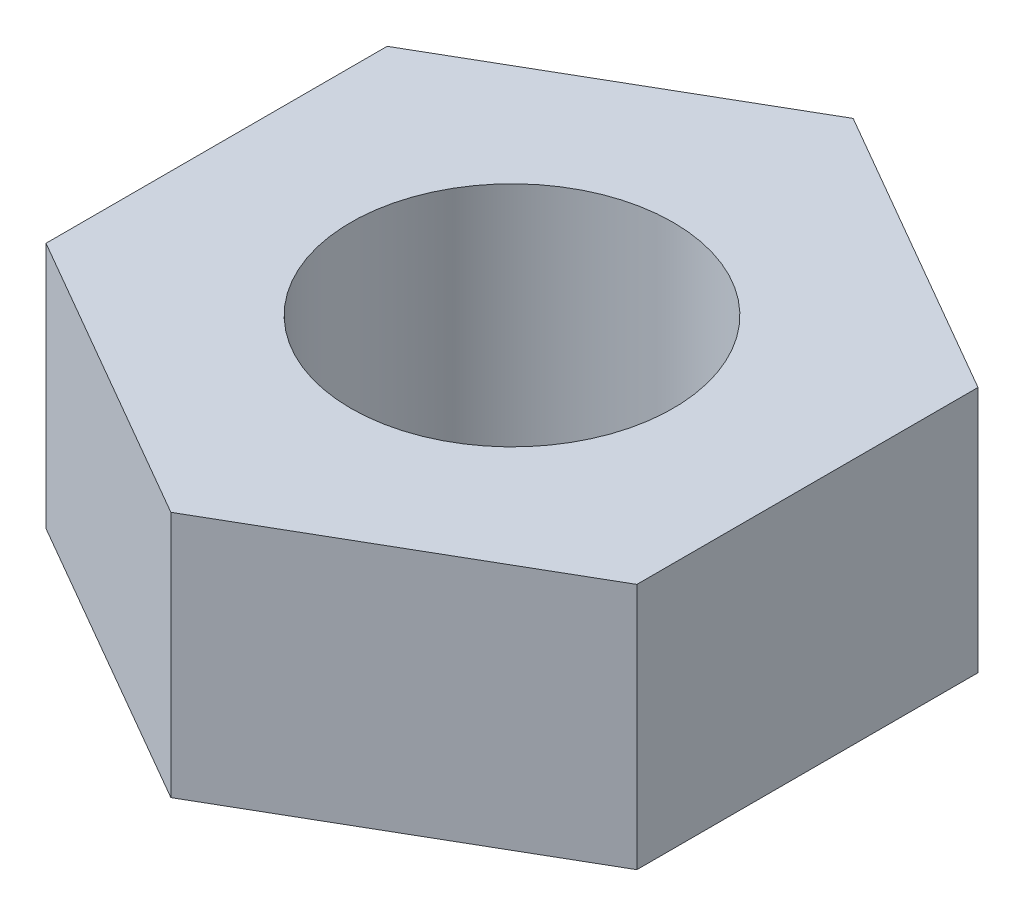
SolidWorks part; units mm, degrees
ref_plane "Front Plane" through (0, 0, 0) normal (0, 0, 1) x (1, 0, 0)
ref_plane "Top Plane" through (0, 0, 0) normal (0, 1, 0) x (1, 0, 0)
ref_plane "Right Plane" through (0, 0, 0) normal (1, 0, 0) x (0, 0, -1)
sketch "Sketch1" plane through (0, 0, 0) normal (0, 1, 0) x (1, 0, 0)
  line L1 (0, 3.1754) -> (-2.75, 1.5877)
  line L2 (-2.75, 1.5877) -> (-2.75, -1.5877)
  line L3 (-2.75, -1.5877) -> (0, -3.1754)
  line L4 (0, -3.1754) -> (2.75, -1.5877)
  line L5 (2.75, -1.5877) -> (2.75, 1.5877)
  line L6 (2.75, 1.5877) -> (0, 3.1754)
  circle A0 centre (0, 0) radius 2.75 construction
  circle A1 centre (0, 0) radius 1.5
extrude "Boss-Extrude1" add sketch "Sketch1" along normal blind 2.3
